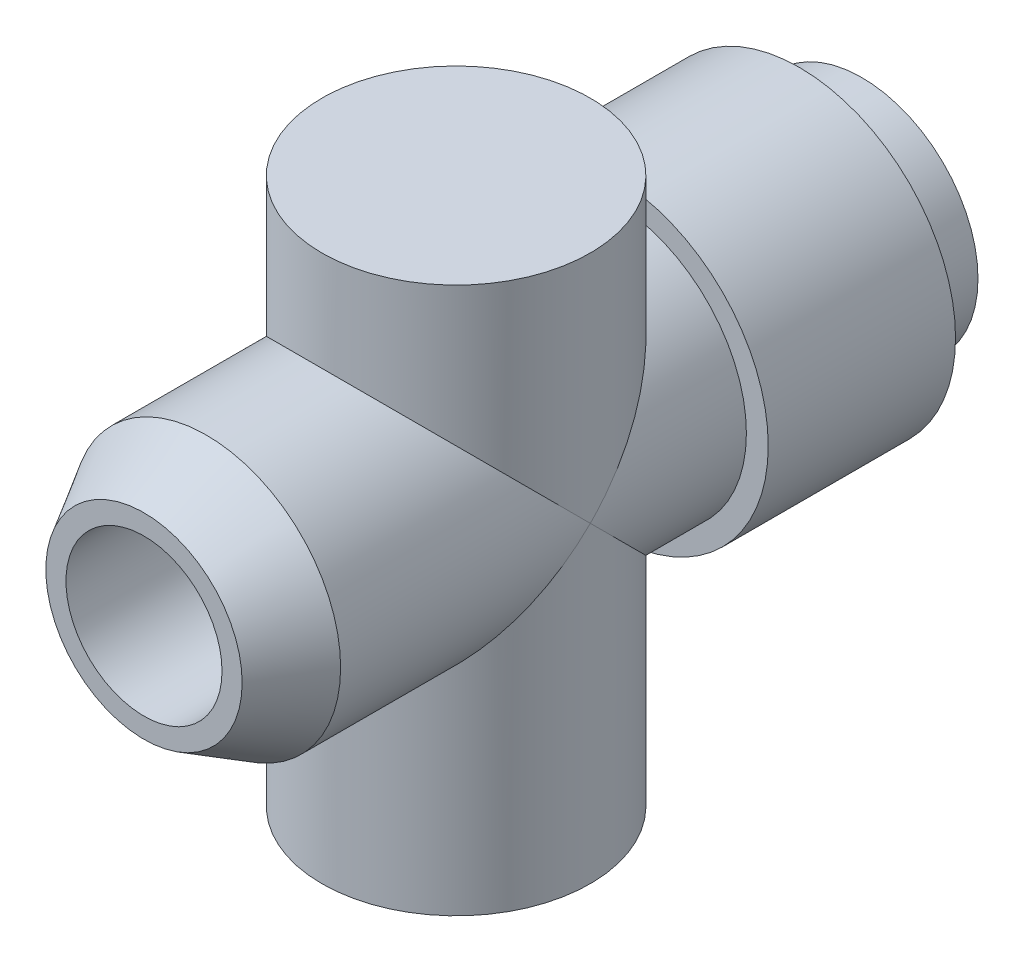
SolidWorks part; units mm, degrees
ref_plane "Front Plane" through (0, 0, 0) normal (0, 0, 1) x (1, 0, 0)
ref_plane "Top Plane" through (0, 0, 0) normal (0, 1, 0) x (1, 0, 0)
ref_plane "Right Plane" through (0, 0, 0) normal (1, 0, 0) x (0, 0, -1)
sketch "Sketch1" plane through (0, 0, 0) normal (0, 0, 1) x (1, 0, 0)
  circle A0 centre (0, 0) radius 4.7244
  dimension "D1" = 9.4488
extrude "inset" add sketch "Sketch1" along normal blind 2.54
sketch "Sketch2" plane through (0, 0, 2.54) normal (0, 0, 1) x (1, 0, 0)
  circle A0 centre (0, 0) radius 6.35
  dimension "D1" = 12.7
extrude "base" add sketch "Sketch2" along normal blind 7.62
sketch "Sketch3" plane through (0, 0, 10.16) normal (0, 0, 1) x (1, 0, 0)
  circle A0 centre (0, 0) radius 5.461
  dimension "D1" = 10.922
extrude "nib" add sketch "Sketch3" along normal blind 19.05
sketch "Sketch4" plane through (0, 0, 29.21) normal (0, 0, 1) x (1, 0, 0)
  circle A0 centre (0, 0) radius 3.175
  dimension "D1" = 6.35
extrude "Cut-Extrude1" cut sketch "Sketch4" against normal through all
sketch "Sketch5" plane through (0, 0, 0) normal (0, 1, 0) x (1, 0, 0)
  line L0 (0, 0) -> (0, -29.21) construction
  line L1 (-5.461, -29.21) -> (5.461, -29.21) construction
  line L2 (-5.461, -10.16) -> (-5.461, -29.21) construction
  line L3 (-5.461, -10.16) -> (5.461, -10.16) construction
  circle A0 centre (0, -16.51) radius 3.175 construction
  circle A1 centre (0, -16.51) radius 5.461
  dimension "D1" = 6.35
  dimension "D2" = 6.35
extrude "Extrude1" add sketch "Sketch5" along normal blind 9.525 and the other way blind 12.7
sketch "Sketch6" plane through (0, -12.7, 0) normal (0, -1, 0) x (1, 0, 0)
  circle A0 centre (0, 16.51) radius 3.175
  dimension "D1" = 6.35
extrude "Cut-Extrude2" cut sketch "Sketch6" against normal blind 20.6375
sketch "Sketch7" plane through (0, 7.9375, 0) normal (0, -1, 0) x (1, 0, 0)
  circle A0 centre (0, 16.51) radius 3.048
extrude "Extrude2" add sketch "Sketch7" along normal blind 1.5875
chamfer "Chamfer1" distance 2.54 angle 30 1 edges at (5.461, 0, 29.21)
